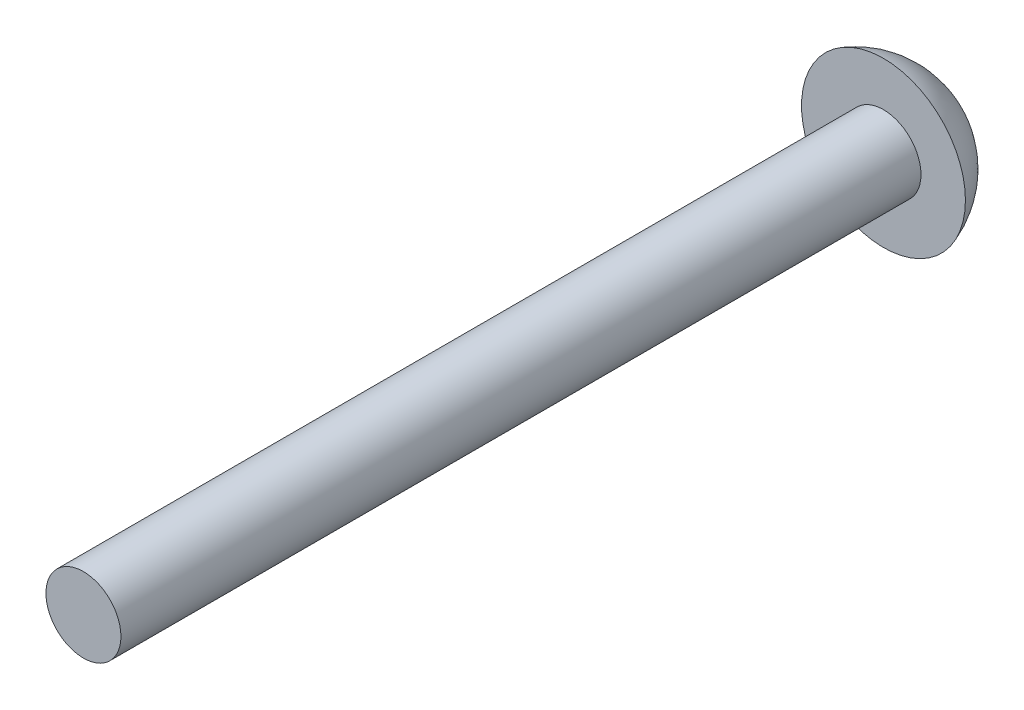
SolidWorks part; units mm, degrees
ref_plane "Front Plane" through (0, 0, 0) normal (0, 0, 1) x (1, 0, 0)
ref_plane "Top Plane" through (0, 0, 0) normal (0, 1, 0) x (1, 0, 0)
ref_plane "Right Plane" through (0, 0, 0) normal (1, 0, 0) x (0, 0, -1)
sketch "Sketch1" plane through (0, 0, 0) normal (0, 0, 1) x (1, 0, 0)
  circle A0 centre (0, 0) radius 0.75
  dimension "D1" = 1.5
extrude "Boss-Extrude1" add sketch "Sketch1" along normal blind 16
sketch "Sketch2" plane through (0, 0, 0) normal (0, 1, 0) x (1, 0, 0)
  line L0 (0, 0) -> (1.6391, 0)
  line L1 (0, 0) -> (0, 1.1738)
  arc A0 (0, 1.1738) -> (1.6391, 0) centre (0, -0.5576) cw
  dimension "D1" = 1.7314
  dimension "D2" = 1.6391
revolve "Revolve1" add sketch "Sketch2" angle 360 about L1
